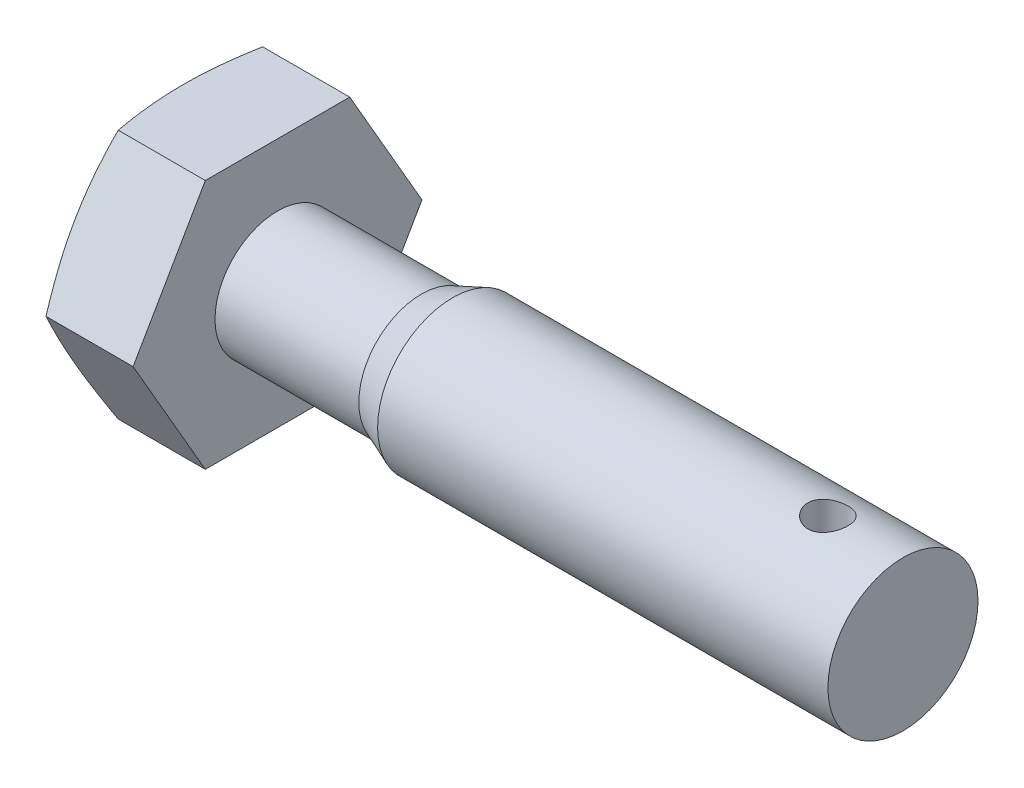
SolidWorks part; units mm, degrees
ref_plane "Front" through (0, 0, 0) normal (0, 0, 1) x (1, 0, 0)
ref_plane "Top" through (0, 0, 0) normal (0, 1, 0) x (1, 0, 0)
ref_plane "Right" through (0, 0, 0) normal (1, 0, 0) x (0, 0, -1)
sketch "Sketch1" plane through (0, 0, 0) normal (1, 0, 0) x (0, 0, -1)
  line L1 (2.8868, -5) -> (5.7735, 0)
  line L2 (5.7735, 0) -> (2.8868, 5)
  line L3 (2.8868, 5) -> (-2.8868, 5)
  line L4 (-2.8868, 5) -> (-5.7735, 0)
  line L5 (-5.7735, 0) -> (-2.8868, -5)
  line L6 (-2.8868, -5) -> (2.8868, -5)
  circle A0 centre (0, 0) radius 5 construction
  dimension "s" = 10
extrude "BaseHead" add sketch "Sketch1" along normal blind 4
ref_plane "Plane1" through (11, 0, 0) normal (1, 0, 0) x (0, 0, -1)
sketch "Sketch2" plane through (4, 0, 0) normal (1, 0, 0) x (0, 0, -1)
  circle A0 centre (0, 0) radius 3
  dimension "d" = 6
extrude "BaseBody" add sketch "Sketch2" along normal blind 25
sketch "Sketch3" plane through (3.1612, 0, 2.6123) normal (0, 1, 0) x (0, 0, -1)
  line L0 (2.6123, 2.0714) -> (2.6123, -1.5224) construction
  line L2 (8.3858, 3.1612) -> (8.3858, 2.6431)
  line L3 (8.3858, 2.6431) -> (6.9623, 3.1612)
  line L5 (6.9623, 3.1612) -> (8.3858, 3.1612)
  dimension "D1" = 20
  dimension "dw" = 8.7
revolve "HeadChamfer" cut sketch "Sketch3" angle 360 about L0
sketch "Sketch4" plane through (0, 0, 0) normal (1, 0, 0) x (0, 0, -1)
  circle A0 centre (0, 0) radius 3.4
  dimension "da" = 6.8
extrude "Cut-Extrude1" cut sketch "Sketch4" along normal blind 0.8
sketch "Sketch5" plane through (-2.9296, 0, 7.9296) normal (0, 1, 0) x (0, 0, -1)
  line L0 (7.9296, -2.9296) -> (7.9296, -19.1832) construction
  line L1 (13.7031, -6.9296) -> (10.8164, -6.9296) construction
  line L2 (10.9296, -13.9296) -> (10.4296, -12.6796)
  line L3 (10.9296, -2.9296) -> (10.9296, -19.1832) construction
  line L4 (10.4296, -12.6796) -> (10.4296, -6.9296)
  line L5 (10.9296, -31.9296) -> (10.9296, -6.9296) construction
  line L6 (10.4296, -6.9296) -> (12.9296, -6.9296)
  line L7 (12.9296, -6.9296) -> (12.9296, -13.9296)
  line L8 (12.9296, -13.9296) -> (10.9296, -13.9296)
  line L9 (4.9296, -31.9296) -> (10.9296, -31.9296) construction
  dimension "D1" = 3
  dimension "ds" = 5
  dimension "x" = 1.25
  dimension "D3" = 18
  dimension "D4" = 10
revolve "Cut-Revolve1" cut sketch "Sketch5" angle 360 about L0
fillet "HeadFillet" [suppressed] radius 0.25
sketch "Sketch6" plane through (0, 0, 0) normal (0, 1, 0) x (1, 0, 0)
  line L0 (4, -2.8868) -> (4, -5.7735) construction
  circle A0 centre (26, 0) radius 0.8
  dimension "d1" = 1.6
  dimension "lh" = 22
extrude "Hole" cut sketch "Sketch6" against normal through all and the other way through all
sketch "Sketch7" plane through (0, 0, 0) normal (0, 0, 1) x (1, 0, 0)
  line L0 (28.73, 3.2) -> (29.27, 3.2)
  line L1 (29.27, 3.2) -> (29.27, 3)
  line L2 (29.27, 3) -> (29, 2.5323)
  line L3 (28.73, 3) -> (29, 2.5323)
  line L4 (28.73, 3.2) -> (28.73, 3)
  line L5 (29.0273, 0) -> (0, 0) construction
  line L6 (28.73, 3) -> (29.27, 3) construction
  line L7 (29, 3) -> (29, 2.5323) construction
  line L8 (29, -3) -> (29, 3) construction
  line L9 (29, 3) -> (26.8, 3) construction
  point P5 (29, 3.2)
  dimension "D1" = 0.2
  dimension "D2" = 0.54
revolve "Cut-Revolve10" [suppressed] cut sketch "Sketch7" angle 360 about L5
pattern_linear "LPattern10" [suppressed] count 28 spacing 0.648 along (1, 0, 0)
equation "\"D1@Cut-Extrude1\" = 0.2 * \"k@BaseHead\""
equation "\"b@ThreadCosmetic1\" = \"l@BaseBody\" - \"lg@Plane1\""
equation "\"D4@Sketch5\" = 2 * \"ds@Sketch5\""
equation "\"D3@Sketch5\" = \"l@BaseBody\" - \"lg@Plane1\""
equation "\"D2@Sketch7\" = (  \"d@Sketch2\" - \"D2@ThreadCosmetic1\" )  / 2"
equation "\"D3@LPattern10\" = \"D2@Sketch7\" * 1.2"
equation "\"D1@LPattern10\" = \"b@ThreadCosmetic1\" / \"D3@LPattern10\""
